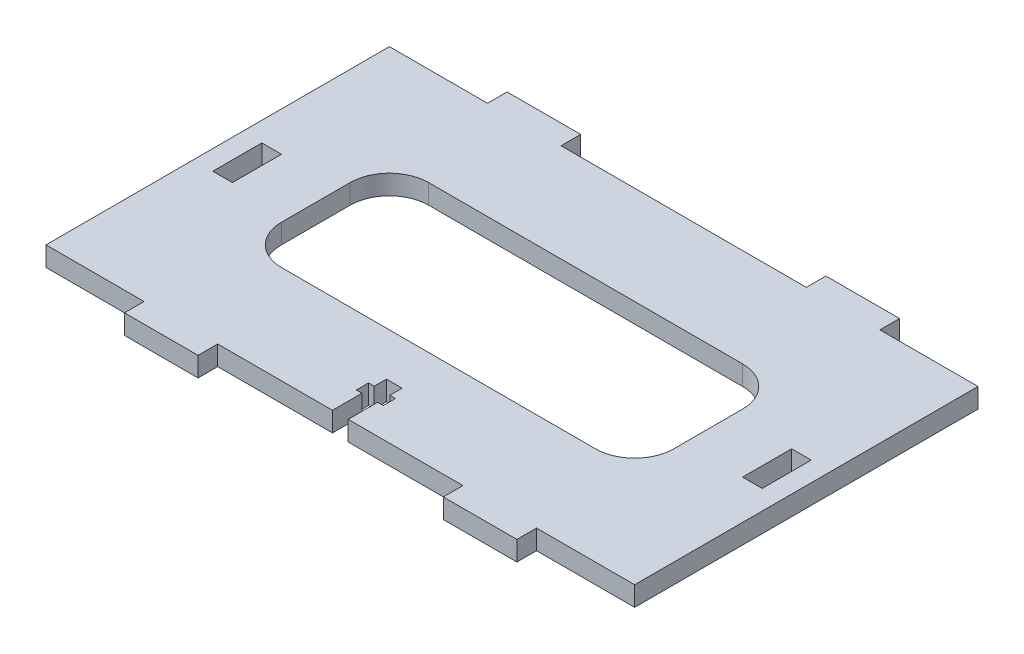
SolidWorks part; units mm, degrees
ref_plane "Ebene vorne" through (0, 0, 0) normal (0, 0, 1) x (1, 0, 0)
ref_plane "Ebene oben" through (0, 0, 0) normal (0, 1, 0) x (1, 0, 0)
ref_plane "Ebene rechts" through (0, 0, 0) normal (1, 0, 0) x (0, 0, -1)
sketch "Skizze1" plane through (0, 0, 0) normal (0, 1, 0) x (1, 0, 0)
  line L0 (0, 48.4677) -> (0, -69.9367) construction
  line L1 (-60, 35) -> (-40, 35)
  line L2 (-60, 35) -> (-60, -35)
  line L3 (-60, -35) -> (-40, -35)
  line L4 (60, 35) -> (60, -35)
  line L5 (-63.2683, 0) -> (64.2442, 0) construction
  line L6 (40, 39) -> (40, 35)
  line L7 (-32, 15) -> (32, 15)
  line L8 (-40, 7) -> (-40, -7)
  line L9 (-32, -15) -> (32, -15)
  line L10 (40, 7) -> (40, -7)
  line L11 (-40, 39) -> (-25, 39)
  line L12 (-40, 39) -> (-40, 35)
  line L13 (40, 35) -> (60, 35)
  line L14 (-25, 39) -> (-25, 35)
  line L15 (25, 39) -> (25, 35)
  line L16 (40, 39) -> (25, 39)
  line L17 (40, -39) -> (25, -39)
  line L18 (25, -39) -> (25, -35)
  line L19 (-25, -39) -> (-25, -35)
  line L20 (-40, -39) -> (-25, -39)
  line L21 (-40, -39) -> (-40, -35)
  line L22 (40, -39) -> (40, -35)
  line L23 (-25, 35) -> (25, 35)
  line L24 (40, -35) -> (60, -35)
  line L25 (-25, -35) -> (-1.6, -35)
  line L26 (56, 5) -> (52, 5)
  line L27 (-56, 5) -> (-52, 5)
  line L28 (-56, 5) -> (-56, -5)
  line L29 (-56, -5) -> (-52, -5)
  line L30 (-52, 5) -> (-52, -5)
  line L31 (56, 5) -> (56, -5)
  line L32 (56, -5) -> (52, -5)
  line L33 (52, 5) -> (52, -5)
  line L34 (1.6, -29) -> (2.75, -29)
  line L35 (-1.6, -24) -> (1.6, -24)
  line L36 (-1.6, -24) -> (-1.6, -26.5)
  line L38 (1.6, -24) -> (1.6, -26.5)
  line L39 (-2.75, -26.5) -> (-1.6, -26.5)
  line L40 (-2.75, -26.5) -> (-2.75, -29)
  line L41 (-2.75, -29) -> (-1.6, -29)
  line L42 (2.75, -26.5) -> (2.75, -29)
  line L43 (1.6, -26.5) -> (2.75, -26.5)
  line L44 (-1.6, -29) -> (-1.6, -35)
  line L45 (1.6, -29) -> (1.6, -35)
  line L46 (1.6, -35) -> (25, -35)
  arc A0 (-40, -7) -> (-32, -15) centre (-32, -7) ccw
  arc A1 (32, -15) -> (40, -7) centre (32, -7) ccw
  arc A2 (40, 7) -> (32, 15) centre (32, 7) ccw
  arc A3 (-32, 15) -> (-40, 7) centre (-32, 7) ccw
  dimension "D3" = 20
  dimension "D7" = 8
  dimension "D1" = 70
  dimension "D2" = 120
  dimension "D4" = 20
  dimension "D5" = 20
  dimension "D6" = 20
  dimension "D8" = 4
  dimension "D9" = 15
  dimension "D10" = 25
  dimension "D11" = 10
  dimension "D12" = 4
  dimension "D13" = 3.2
  dimension "D14" = 4
  dimension "D15" = 5.5
  dimension "D16" = 2.5
  dimension "D17" = 11
  dimension "D18" = 6
extrude "Aufsatz-Linear austragen1" add sketch "Skizze1" along normal blind 4
